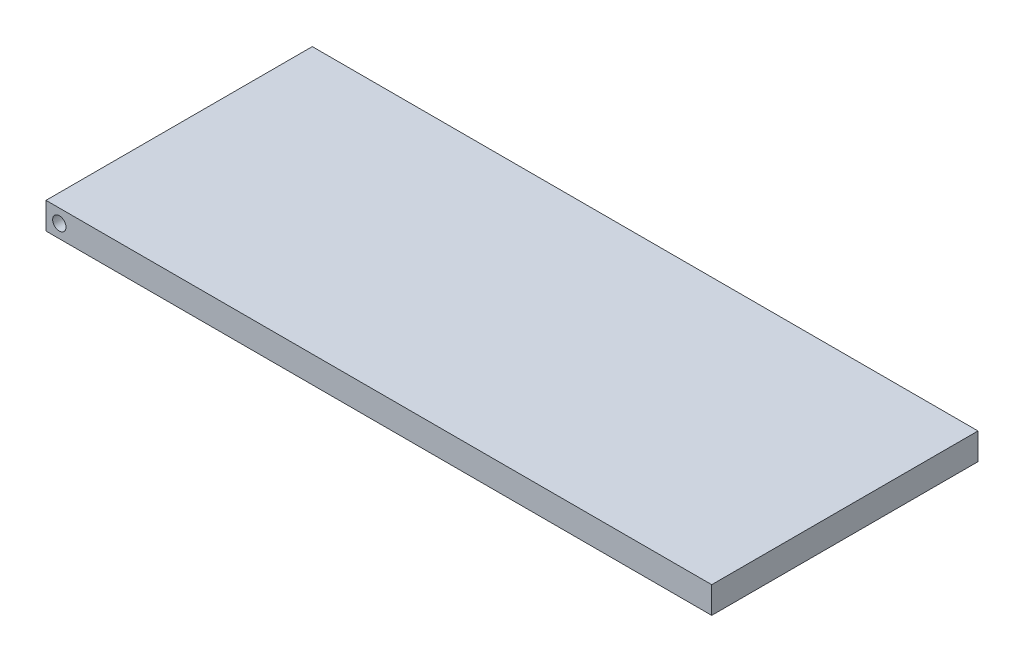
SolidWorks part; units mm, degrees
ref_plane "Plan de face" through (0, 0, 0) normal (0, 0, 1) x (1, 0, 0)
ref_plane "Plan de dessus" through (0, 0, 0) normal (0, 1, 0) x (1, 0, 0)
ref_plane "Plan de droite" through (0, 0, 0) normal (1, 0, 0) x (0, 0, -1)
sketch "Esquisse1" plane through (0, 0, 0) normal (0, 0, 1) x (1, 0, 0)
  line L1 (0, 0) -> (500, 0)
  line L2 (0, 0) -> (0, 20)
  line L3 (0, 20) -> (500, 20)
  line L4 (500, 0) -> (500, 20)
  dimension "D1" = 20
  dimension "D2" = 500
extrude "Boss.-Extru.1" add sketch "Esquisse1" against normal blind 200
sketch "Esquisse2" plane through (0, 0, 0) normal (0, 0, 1) x (1, 0, 0)
  line L0 (0, 20) -> (0, 0) construction
  line L1 (500, 20) -> (0, 20) construction
  circle A0 centre (10, 10) radius 5
  dimension "D1" = 10
  dimension "D2" = 10
  dimension "D3" = 10
extrude "Enlèv. mat.-Extru.1" cut sketch "Esquisse2" against normal through all
